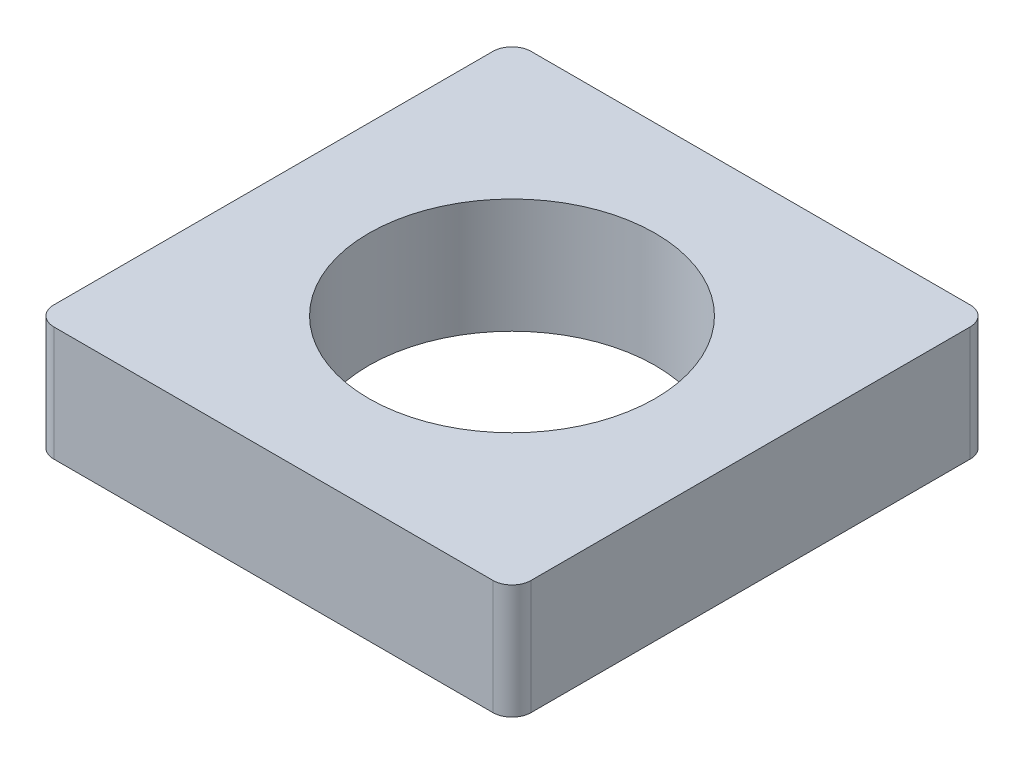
SolidWorks part; units mm, degrees
ref_plane "Front Plane" through (0, 0, 0) normal (0, 0, 1) x (1, 0, 0)
ref_plane "Top Plane" through (0, 0, 0) normal (0, 1, 0) x (1, 0, 0)
ref_plane "Right Plane" through (0, 0, 0) normal (1, 0, 0) x (0, 0, -1)
sketch "Sketch1" plane through (0, 0, 0) normal (0, 1, 0) x (1, 0, 0)
  line L1 (58.42, -63.5) -> (-58.42, -63.5)
  line L2 (63.5, -58.42) -> (63.5, 58.42)
  line L3 (58.42, 63.5) -> (-58.42, 63.5)
  line L4 (-63.5, -58.42) -> (-63.5, 58.42)
  line L5 (63.5, -63.5) -> (-63.5, 63.5) construction
  line L6 (63.5, 63.5) -> (-63.5, -63.5) construction
  arc A0 (58.42, 63.5) -> (63.5, 58.42) centre (58.42, 58.42) cw
  arc A1 (63.5, -58.42) -> (58.42, -63.5) centre (58.42, -58.42) cw
  arc A2 (-58.42, -63.5) -> (-63.5, -58.42) centre (-58.42, -58.42) cw
  arc A3 (-63.5, 58.42) -> (-58.42, 63.5) centre (-58.42, 58.42) cw
  circle A4 centre (0, 0) radius 38.1
  point P0 (0, 0)
  dimension "D3" = 5.08
  dimension "D4" = 76.2
  dimension "D1" = 127
  dimension "D2" = 127
extrude "Boss-Extrude1" add sketch "Sketch1" along normal blind 30.48
sketch "Sketch2" plane through (0, 0, 0) normal (0, -1, 0) x (1, 0, 0)
  circle A0 centre (41.91, 0) radius 2.286
  circle A1 centre (0, 0) radius 38.1 construction
  dimension "D1" = 4.572
  dimension "D2" = 41.91
extrude "Cut-Extrude1" cut sketch "Sketch2" against normal blind 10.16
